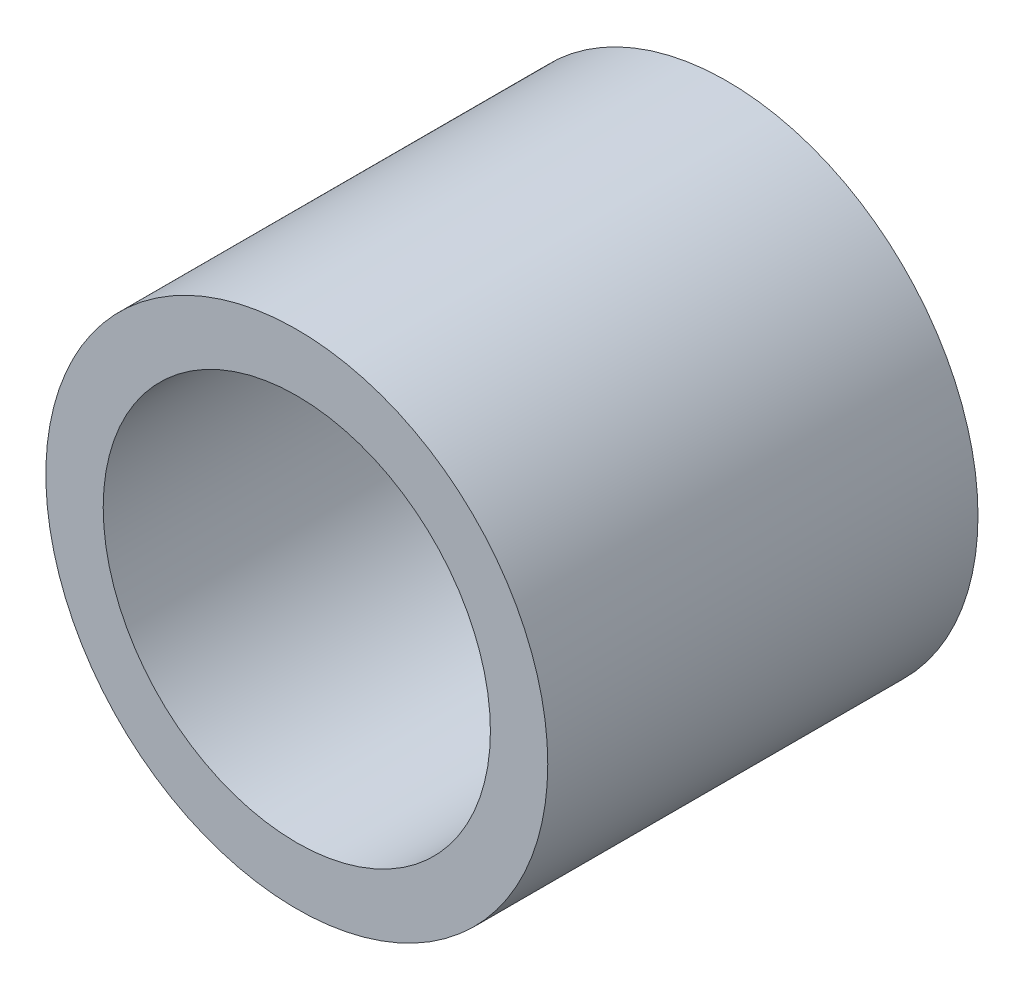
SolidWorks part; units mm, degrees
ref_plane "Plan1" through (0, 0, 0) normal (0, 0, 1) x (1, 0, 0)
ref_plane "Plan2" through (0, 0, 0) normal (0, 1, 0) x (1, 0, 0)
ref_plane "Plan3" through (0, 0, 0) normal (1, 0, 0) x (0, 0, -1)
sketch "Esquisse1" plane through (0, 0, 0) normal (0, 0, 1) x (1, 0, 0)
  circle A0 centre (0, 0) radius 17.5
  dimension "D1" = 35
extrude "Base-Extrusion" add sketch "Esquisse1" along normal blind 30
sketch "Esquisse2" plane through (0, 0, 30) normal (0, 0, 1) x (1, 0, 0)
  circle A0 centre (0, 0) radius 13.5
  dimension "D1" = 27
extrude "Enlèv. mat.-Extru.1" cut sketch "Esquisse2" against normal blind 30
